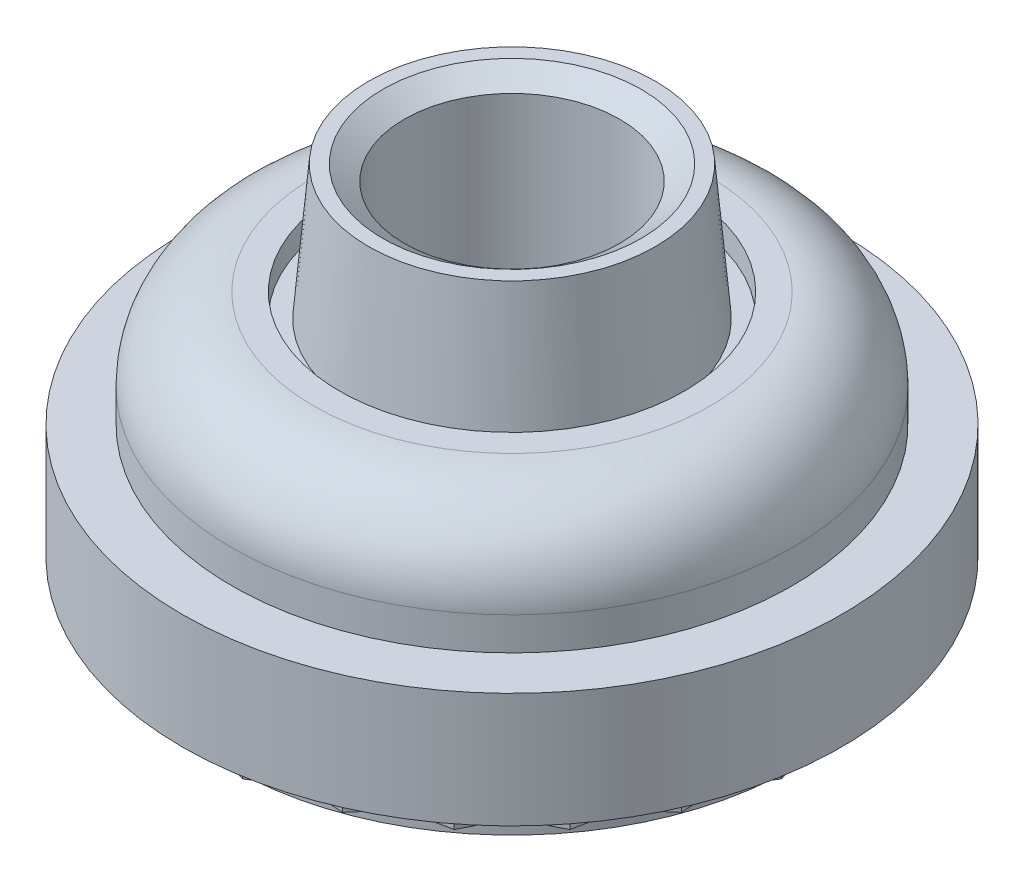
SolidWorks part; units mm, degrees
ref_plane "Plane1" through (0, 0, 0) normal (0, 0, 1) x (1, 0, 0)
ref_plane "Plane2" through (0, 0, 0) normal (0, 1, 0) x (1, 0, 0)
ref_plane "Plane3" through (0, 0, 0) normal (1, 0, 0) x (0, 0, -1)
sketch "BodySke" plane through (0, 0, 0) normal (0, 0, 1) x (1, 0, 0)
  line L0 (6.316, 0) -> (7.65, 0)
  line L1 (7.65, 0) -> (7.65, 2.665)
  line L2 (3.3276, 7.9) -> (2.5, 7.9)
  line L3 (2.5, 7.9) -> (2.5, -0.97)
  line L4 (2.5, -0.97) -> (6.54, -0.97)
  line L5 (6.54, -0.97) -> (6.54, -0.776)
  line L6 (6.54, -0.776) -> (6.316, -0.388)
  line L7 (1.016, 1) -> (3.6522, 1) construction
  line L9 (0, 0) -> (0, 15.24) construction
  line L10 (6.316, -0.388) -> (6.316, 0)
  line L11 (3.6, 4.787) -> (4, 4.787)
  line L12 (4, 4.787) -> (4, 5.33)
  line L13 (4, 5.33) -> (4.6, 5.33)
  line L14 (7.65, 2.665) -> (6.5, 2.665)
  line L15 (6.5, 2.665) -> (6.5, 3.43)
  line L16 (3.6, 4.787) -> (3.3276, 7.9)
  arc A0 (6.5, 3.43) -> (4.6, 5.33) centre (4.6, 3.43) ccw
  dimension "D1" = 60
  dimension "E_dia" = 15.3
  dimension "C_dia" = 13.08
  dimension "A_ht" = 0.97
  dimension "Thread_min" = 5
  dimension "C_len" = 0.194
  dimension "Clinching_ht" = 0.388
  dimension "Advance" = 1
  dimension "T2_ht" = 7.9
  dimension "Nose_dia" = 7.2
  dimension "Guide_dia" = 8
  dimension "Top_flat_wid" = 0.6
  dimension "T1_ht" = 5.33
  dimension "T2_nl_lim" = 4.787
  dimension "D_dia" = 13
  dimension "Shoulder_ht" = 2.665
  dimension "Nose_ang" = 175
revolve "Body" add sketch "BodySke"
revolve "EndChamfer" cut sketch "EndChamferSke" angle 360 about L0
sketch "EndChamferSke" plane through (0, 0, 0) normal (0, 0, 1) x (1, 0, 0)
  line L0 (0, -2.54) -> (0, 7.62) construction
  line L1 (0, 0) -> (0, 15.24) construction
  line L2 (3, -1.224) -> (3, -0.9675)
  line L3 (3, -0.9675) -> (2.5, -0.6175)
  line L4 (2.5, -0.6175) -> (2.5, -1.224)
  line L5 (2.5, -1.224) -> (3, -1.224)
  line L6 (3, 7.9) -> (2.5, 7.55)
  line L8 (2.5, 7.55) -> (2.5, 7.9)
  line L9 (3, 7.9) -> (2.5, 7.9)
  line L10 (2.5, 7.9) -> (-2.5, 7.9) construction
  line L11 (-6.54, -0.97) -> (6.54, -0.97) construction
  dimension "D1" = 0.254
  dimension "Thread_nominal" = 6
  dimension "D2" = 34.99
  dimension "Thread_min" = 5
  dimension "Inset" = 0.0025
sketch "CliRinSegSke" plane through (0, 0, 0) normal (0, -1, 0) x (1, 0, 0)
  line L0 (0, 0) -> (0, 7.62) construction
  line L1 (0.9486, 7.2053) -> (0, 6.885)
  line L2 (0, 6.885) -> (-0.9486, 7.2053)
  line L3 (-0.9486, 7.2053) -> (-0.9201, 6.9892)
  line L4 (-0.9201, 6.9892) -> (0, 6.6785)
  line L5 (0, 6.6785) -> (0.9201, 6.9892)
  line L6 (0.9201, 6.9892) -> (0.9486, 7.2053)
  circle A0 centre (0, 0) radius 7.2675 construction
  circle A1 centre (0, 0) radius 6.885 construction
  circle A2 centre (0, 0) radius 6.6785 construction
  circle A3 centre (0, 0) radius 7.0495 construction
  circle A4 centre (0, 0) radius 6.54 construction
  dimension "D2" = 14.099
  dimension "D3" = 13.77
  dimension "D4" = 13.3569
  dimension "D1" = 14.535
  dimension "Angle" = 15
ref_plane "Plane4" through (0, -0.5486, 0) normal (0, 1, 0) x (-1, 0, 0)
sketch "ThdSchSke" plane through (0, 0, 0) normal (0, 0, 1) x (1, 0, 0)
  line L0 (0, -5.08) -> (0, 7.62) construction
  line L1 (0, 0) -> (0, 15.24) construction
  line L2 (0, -0.9675) -> (3, -0.9675) construction
  line L4 (3, -0.9675) -> (2.5, -0.6174)
  line L6 (3, -0.9675) -> (2.5, -1.3176)
  line L7 (2.5, -0.6174) -> (2.5, -1.3176)
  line L8 (3, -0.9675) -> (-3, -0.9675) construction
  dimension "Vee_angle" = 70
  dimension "Thread_nominal" = 6
  dimension "Thread_min" = 5
revolve "ThreadSchematic" [suppressed] cut sketch "ThdSchSke" angle 360 about L0
pattern_linear "ThdSchPat" [suppressed]
extrude "ClinchingRingSegment" add sketch "CliRinSegSke" along normal blind 0.388
pattern_circular "ClinchingRing" count 24 every 15 about axis through (0, 0, 0) along (0, 1, 0) of "ClinchingRingSegment"
sketch "SqrCutSke" plane through (0, -0.97, 0) normal (0, -1, 0) x (1, 0, 0)
  line L0 (3.6, -3.346) -> (3.6, 3.346)
  line L1 (3.346, 3.6) -> (-3.346, 3.6)
  line L2 (-3.6, 3.346) -> (-3.6, -3.346)
  line L3 (-3.346, -3.6) -> (3.346, -3.6)
  line L4 (-3.346, -3.981) -> (3.346, -3.981)
  line L5 (-3.981, 3.346) -> (-3.981, -3.346)
  line L6 (3.346, 3.981) -> (-3.346, 3.981)
  line L7 (3.981, -3.346) -> (3.981, 3.346)
  circle A0 centre (0, 0) radius 3.6 construction
  circle A1 centre (0, 0) radius 3.6 construction
  circle A4 centre (0, 0) radius 5.0912 construction
  arc A6 (-3.6, 3.346) -> (-3.346, 3.6) centre (-3.346, 3.346) cw
  arc A7 (3.6, 3.346) -> (3.346, 3.6) centre (3.346, 3.346) ccw
  arc A8 (3.346, -3.6) -> (3.6, -3.346) centre (3.346, -3.346) ccw
  arc A9 (-3.6, -3.346) -> (-3.346, -3.6) centre (-3.346, -3.346) ccw
  arc A10 (-3.981, -3.346) -> (-3.346, -3.981) centre (-3.346, -3.346) ccw
  arc A11 (-3.981, 3.346) -> (-3.346, 3.981) centre (-3.346, 3.346) cw
  arc A12 (3.981, 3.346) -> (3.346, 3.981) centre (3.346, 3.346) ccw
  arc A13 (3.346, -3.981) -> (3.981, -3.346) centre (3.346, -3.346) ccw
  point P12 (-3.6, 3.6)
  point P15 (3.6, 3.6)
  point P18 (3.6, -3.6)
  point P21 (-3.6, -3.6)
  dimension "D1" = 0.254
  dimension "D2" = 0.381
extrude "SqrCut" cut sketch "SqrCutSke" against normal blind 0.97
equation "' \"A_ht@BodySke\" = 0.97"
equation "' \"C_dia@BodySke\" = 13.08"
equation "' \"D_dia@BodySke\" = 13"
equation "' \"E_dia@BodySke\" = 15.3"
equation "' \"T1_ht@BodySke\" = 5.33"
equation "' \"T2_ht@BodySke\" = 7.9"
equation "' \"Advance@BodySke\" = 1"
equation "' \"Thread_min@BodySke\" = 5"
equation "' \"Thread_nominal@ThreadCosmetic\" = 6"
equation "' \"Nose_ang@BodySke\" = 175"
equation "' \"T2_ht@BodySke\" =  \"T1_ht@BodySke\" * 0.9 ' make NL"
equation "\"Nose_dia@BodySke\" = \"Thread_nominal@ThreadCosmetic\" * 1.2"
equation "\"Top_flat_wid@BodySke\" = \"Thread_nominal@ThreadCosmetic\" * 0.1"
equation "\"Guide_dia@BodySke\" = \"Nose_dia@BodySke\" + 0.8"
equation "\"T2_nl_lim@BodySke\" = \"T1_ht@BodySke\" * 0.9 - 0.01"
equation "\"Shoulder_ht@BodySke\" = \"T1_ht@BodySke\" * 0.5"
equation "\"Depth@SqrCut\" = \"A_ht@BodySke\""
equation "\"Count@ClinchingRing\" = 24"
equation "\"Angle@ClinchingRing\" = 360 / \"Count@ClinchingRing\""
equation "\"Angle@CliRinSegSke\" = 360 / \"Count@ClinchingRing\""
equation "\"D1@CliRinSegSke\" = \"E_dia@BodySke\" * 0.95"
equation "\"D2@CliRinSegSke\" = \"D1@CliRinSegSke\" * 0.97"
equation "\"D3@CliRinSegSke\" = \"E_dia@BodySke\" * 0.9"
equation "\"D4@CliRinSegSke\" = \"D3@CliRinSegSke\" * 0.97"
equation "\"C_len@BodySke\" = \"A_ht@BodySke\" * 0.2"
equation "\"Clinching_ht@BodySke\" = \"A_ht@BodySke\" * 0.4"
equation "\"Clinching_ht@ClinchingRingSegment\" =  \"A_ht@BodySke\" * 0.4"
equation "\"Thread_nominal@EndChamferSke\" = \"Thread_nominal@ThreadCosmetic\""
equation "\"Thread_min@EndChamferSke\" = \"Thread_min@BodySke\""
equation "\"D2@EndChamferSke\" = \"Vee_angle@ThdSchSke\" / 2 - 0.01"
equation "\"Thread_nominal@ThdSchSke\" = \"Thread_nominal@ThreadCosmetic\""
equation "\"Thread_min@ThdSchSke\" = \"Thread_min@BodySke\""
equation "\"Num_threads@ThdSchPat\" = int(  ( \"A_ht@BodySke\" + \"T2_ht@BodySke\" - \"Inset@EndChamferSke\" ) / \"Advance@BodySke\" + 0.999 )  + 1"
equation "\"Advance@ThdSchPat\" = (  \"A_ht@BodySke\" + \"T2_ht@BodySke\" - \"Inset@EndChamferSke\"  ) /  (\"Num_threads@ThdSchPat\" - 1) 'relax it"
